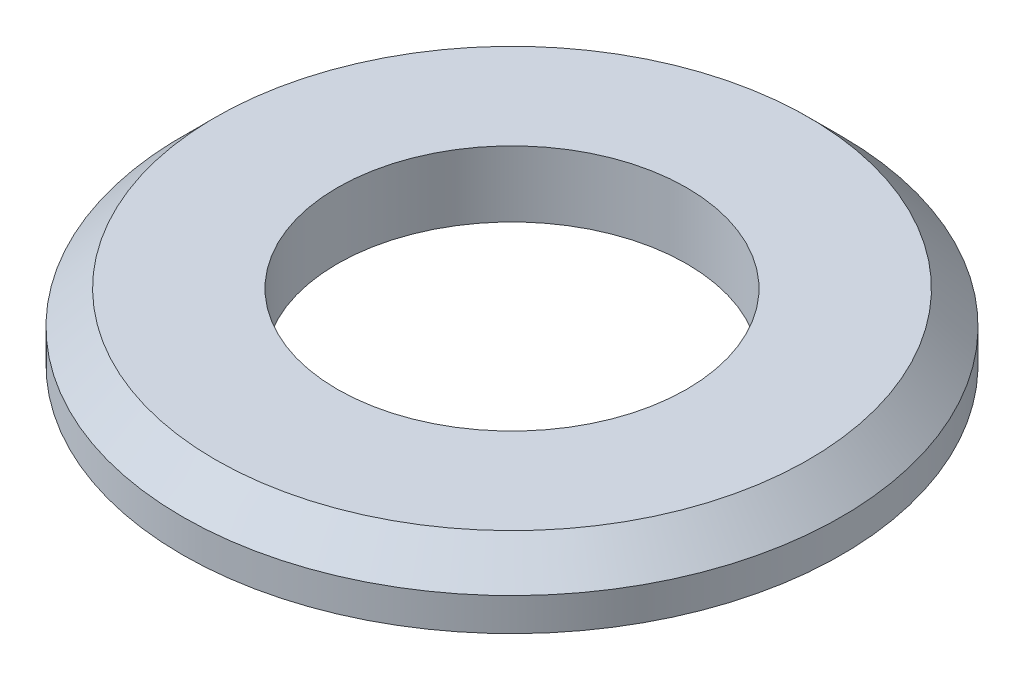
SolidWorks part; units mm, degrees
ref_plane "Front" through (0, 0, 0) normal (0, 0, 1) x (1, 0, 0)
ref_plane "Top" through (0, 0, 0) normal (0, 1, 0) x (1, 0, 0)
ref_plane "Right" through (0, 0, 0) normal (1, 0, 0) x (0, 0, -1)
sketch "Sketch1" plane through (0, 0, 0) normal (0, 1, 0) x (1, 0, 0)
  circle A0 centre (0, 0) radius 2.65
  circle A1 centre (0, 0) radius 5
extrude "Extrude1" add sketch "Sketch1" along normal blind 1
chamfer "Chamfer1" distance 0.5 1 edges at (0, 1, 5)
